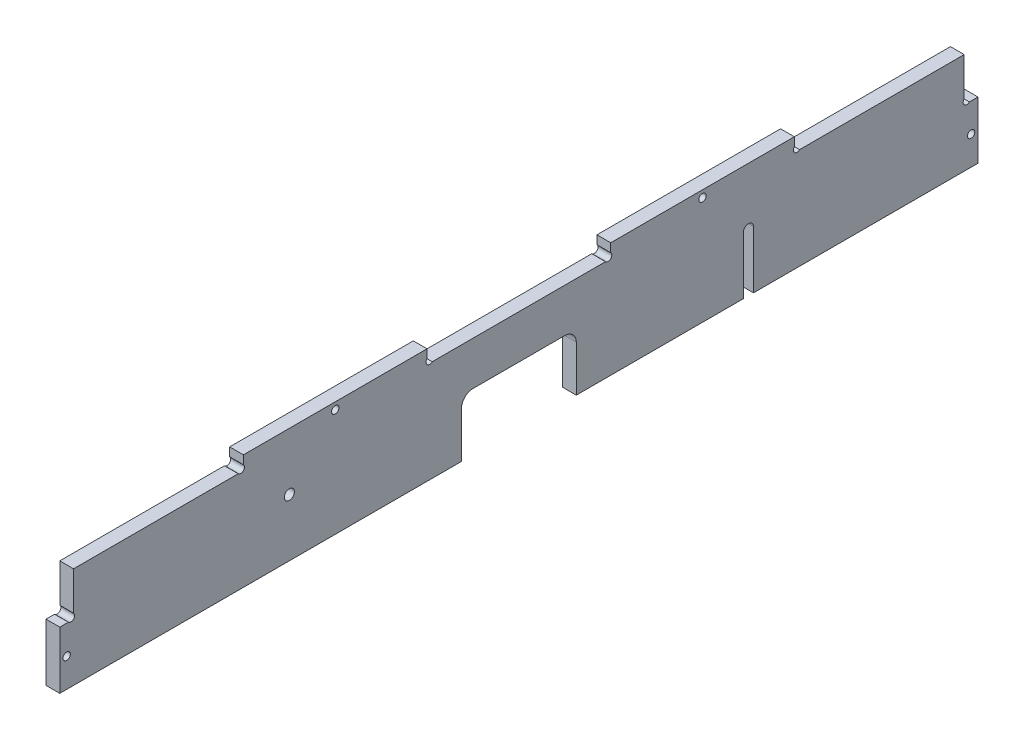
SolidWorks part; units mm, degrees
ref_plane "Plan de face" through (0, 0, 0) normal (0, 0, 1) x (1, 0, 0)
ref_plane "Plan de dessus" through (0, 0, 0) normal (0, 1, 0) x (1, 0, 0)
ref_plane "Plan de droite" through (0, 0, 0) normal (1, 0, 0) x (0, 0, -1)
sketch "Esquisse1" plane through (0, 0, 0) normal (1, 0, 0) x (0, 0, -1)
  line L0 (243.8929, 0) -> (-224.828, 0) construction
  line L1 (0, -8.5433) -> (0, 84.8201) construction
  line L2 (243.8929, 50) -> (-224.828, 50) construction
  line L3 (200, 95.6875) -> (200, -8.5433) construction
  line L4 (-200, -8.5433) -> (-200, 95.6875) construction
  line L5 (217.6455, 44) -> (-56.3075, 44) construction
  line L6 (40, 64.6954) -> (40, 41.7955) construction
  line L7 (80, 73.9528) -> (80, 41.7955) construction
  line L8 (88.8387, 47) -> (77.196, 47) construction
  line L9 (40, 44) -> (28.0412, 55.9588) construction
  line L10 (40, 46.2627) -> (40, 50)
  line L11 (40, 50) -> (120, 50)
  line L12 (120, 50) -> (120, 46.2627)
  line L13 (-40, 50) -> (-120, 50)
  line L14 (-120, 50) -> (-120, 46.2627)
  line L15 (-40, 46.2627) -> (-40, 50)
  line L16 (226.9484, 25) -> (-122.2627, 25) construction
  line L17 (194, 60.1452) -> (194, 18.5483) construction
  line L18 (217.6455, 12.5) -> (191.089, 12.5) construction
  line L19 (197, 19.7403) -> (197, 10.8885) construction
  line L20 (194, 25) -> (204.7696, 35.7696) construction
  line L21 (122.2627, 44) -> (194, 44)
  line L22 (194, 44) -> (194, 27.2627)
  line L23 (196.2627, 25) -> (200, 25)
  line L24 (200, 25) -> (200, 0)
  line L25 (-200, 25) -> (-200, 0)
  line L26 (-196.2627, 25) -> (-200, 25)
  line L27 (-194, 44) -> (-194, 27.2627)
  line L28 (-122.2627, 44) -> (-194, 44)
  line L29 (-37.7373, 44) -> (37.7373, 44)
  line L30 (-200, 0) -> (-25, 0)
  line L31 (-100, 35.7696) -> (-100, -8.5433) construction
  line L32 (97.8, 25) -> (97.8, 0)
  line L33 (102.2, 25) -> (102.2, 0)
  line L34 (102.2, 0) -> (200, 0)
  line L35 (-25, 33.5359) -> (-25, -5.0292) construction
  line L36 (-25, 20) -> (-25, 0)
  line L37 (25, 20) -> (25, 0)
  line L38 (-20, 25) -> (20, 25)
  line L39 (25, 0) -> (97.8, 0)
  arc A0 (37.7373, 44) -> (40, 46.2627) centre (38.8686, 45.1314) ccw
  circle A1 centre (80, 47) radius 1.6
  arc A2 (122.2627, 44) -> (120, 46.2627) centre (121.1314, 45.1314) cw
  arc A3 (-122.2627, 44) -> (-120, 46.2627) centre (-121.1314, 45.1314) ccw
  arc A4 (-37.7373, 44) -> (-40, 46.2627) centre (-38.8686, 45.1314) cw
  circle A5 centre (-80, 47) radius 1.6
  arc A6 (194, 27.2627) -> (196.2627, 25) centre (195.1314, 26.1314) ccw
  circle A7 centre (197, 12.5) radius 1.6
  arc A8 (-194, 27.2627) -> (-196.2627, 25) centre (-195.1314, 26.1314) cw
  circle A9 centre (-197, 12.5) radius 1.6
  circle A10 centre (-100, 25) radius 2.2
  arc A11 (97.8, 25) -> (102.2, 25) centre (100, 25) cw
  arc A12 (25, 20) -> (20, 25) centre (20, 20) ccw
  arc A13 (-25, 20) -> (-20, 25) centre (-20, 20) cw
  point P84 (25, 25)
  point P87 (-25, 25)
  dimension "D9" = 6
  dimension "D14" = 100
  dimension "D15" = 25
  dimension "D16" = 5
  dimension "D1" = 50
  dimension "D2" = 200
  dimension "D3" = 400
  dimension "D4" = 80
  dimension "D5" = 40
  dimension "D6" = 6
  dimension "D7" = 3
  dimension "D8" = 45
  dimension "D10" = 25
  dimension "D11" = 12.5
  dimension "D12" = 45
  dimension "D13" = 3
extrude "Boss.-Extru.1" add sketch "Esquisse1" along normal blind 6
